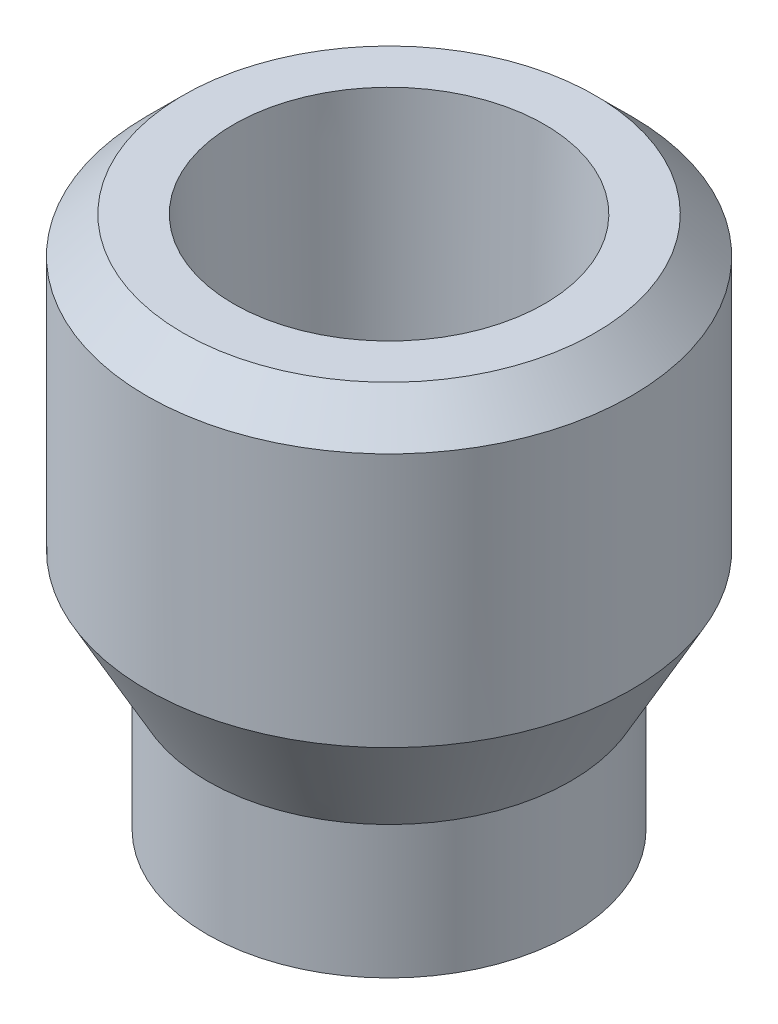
SolidWorks part; units mm, degrees
ref_plane "Přední rovina" through (0, 0, 0) normal (0, 0, 1) x (1, 0, 0)
ref_plane "Horní rovina" through (0, 0, 0) normal (0, 1, 0) x (1, 0, 0)
ref_plane "Pravá rovina" through (0, 0, 0) normal (1, 0, 0) x (0, 0, -1)
sketch "Skica1" plane through (0, 0, 0) normal (0, 1, 0) x (1, 0, 0)
  circle A0 centre (0, 0) radius 15.5
  dimension "D1" = 31
extrude "Přidat vysunutím1" add sketch "Skica1" along normal blind 34.1
sketch "Skica2" plane through (0, 0, 0) normal (0, -1, 0) x (1, 0, 0)
  circle A0 centre (0, 0) radius 11.625
  dimension "D1" = 23.25
extrude "Odebrat vysunutím1" cut sketch "Skica2" against normal blind 15.5 flip side to cut
chamfer "Zkosení1" distance 3.875 distance2 7 1 edges at (0, 15.5, -11.625)
chamfer "Zkosení2" distance 2.325 angle 45 1 edges at (0, 34.1, 15.5)
hole_wizard "1/2 sérii závitu1" positions "Skica4" profile "Skica3" size "1/2" standard "ANSI palce"
sketch "Skica4" plane through (0, 34.1, 0) normal (0, 1, 0) x (-1, 0, 0)
  circle A0 centre (0, 0) radius 13.175 construction
  point P0 (0, 0)
  dimension "D1" = 0
sketch "Skica3" plane through (0, 34.1, 0) normal (1, 0, 0) x (0, 0, 1)
  line L0 (0, 0) -> (0, 27.1546)
  line L1 (8.9281, 22) -> (0, 27.1546)
  line L2 (-8.9281, 22) -> (0, 27.1546) construction
  line L3 (8.9281, 22) -> (8.9281, 15.5)
  line L4 (8.9281, 15.5) -> (9.4797, 15.5)
  line L5 (9.4797, 15.5) -> (9.9438, 0)
  line L6 (-9.4797, 15.5) -> (-9.9438, 0) construction
  line L7 (9.9438, 0) -> (0, 0)
  line L8 (0, -6.35) -> (0, 107.95) construction
  line L11 (-8.9281, 15.5) -> (-9.4797, 15.5) construction
  dimension "Průměr závitníku" = 17.8562
  dimension "Hloubka závitníku" = 22
  dimension "Průměr závitu" = 19.8876
  dimension "Úhel závitu" = 3.43
  dimension "Hloubka závitu" = 15.5
  dimension "Úhel vrtání" = 120
sketch "Skica5" plane through (0, 0, 0) normal (0, -1, 0) x (1, 0, 0)
  circle A0 centre (0, 0) radius 5.5
  dimension "D1" = 11
extrude "Odebrat vysunutím2" cut sketch "Skica5" against normal through all
